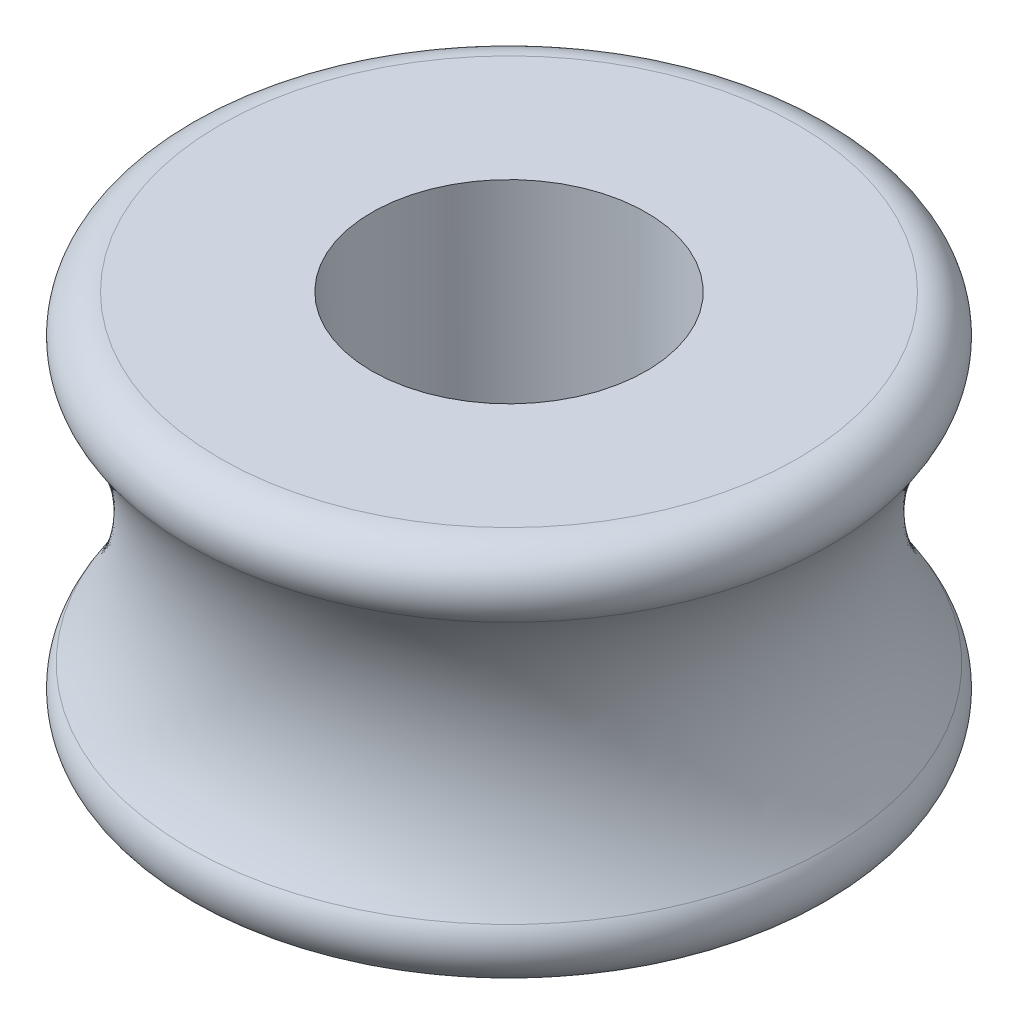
SolidWorks part; units mm, degrees
ref_plane "Front Plane" through (0, 0, 0) normal (0, 0, 1) x (1, 0, 0)
ref_plane "Top Plane" through (0, 0, 0) normal (0, 1, 0) x (1, 0, 0)
ref_plane "Right Plane" through (0, 0, 0) normal (1, 0, 0) x (0, 0, -1)
sketch "Sketch1" plane through (0, 0, 0) normal (0, 0, 1) x (1, 0, 0)
  line L0 (-3.786, 0) -> (-1.8, 0)
  line L1 (-1.8, 0) -> (-1.8, -5)
  line L2 (-1.8, -5) -> (-3.786, -5)
  line L3 (0, 0) -> (0, -5) construction
  arc A0 (-4.1964, -0.7857) -> (-4.1964, -4.2143) centre (-6.6583, -2.5) cw
  arc A1 (-4.1964, -4.2143) -> (-3.786, -5) centre (-3.786, -4.5) ccw
  arc A2 (-4.1964, -0.7857) -> (-3.786, 0) centre (-3.786, -0.5) cw
  point P10 (-5, -5)
  point P13 (-5, 0)
  dimension "D4" = 3
  dimension "D5" = 0.5
  dimension "D1" = 1.8
  dimension "D2" = 5
  dimension "D3" = 5
revolve "Revolve1" add sketch "Sketch1" angle 360 about L3
chamfer "Chamfer1" distance 0.5 angle 45 1 edges at (0, -5, 1.8)
